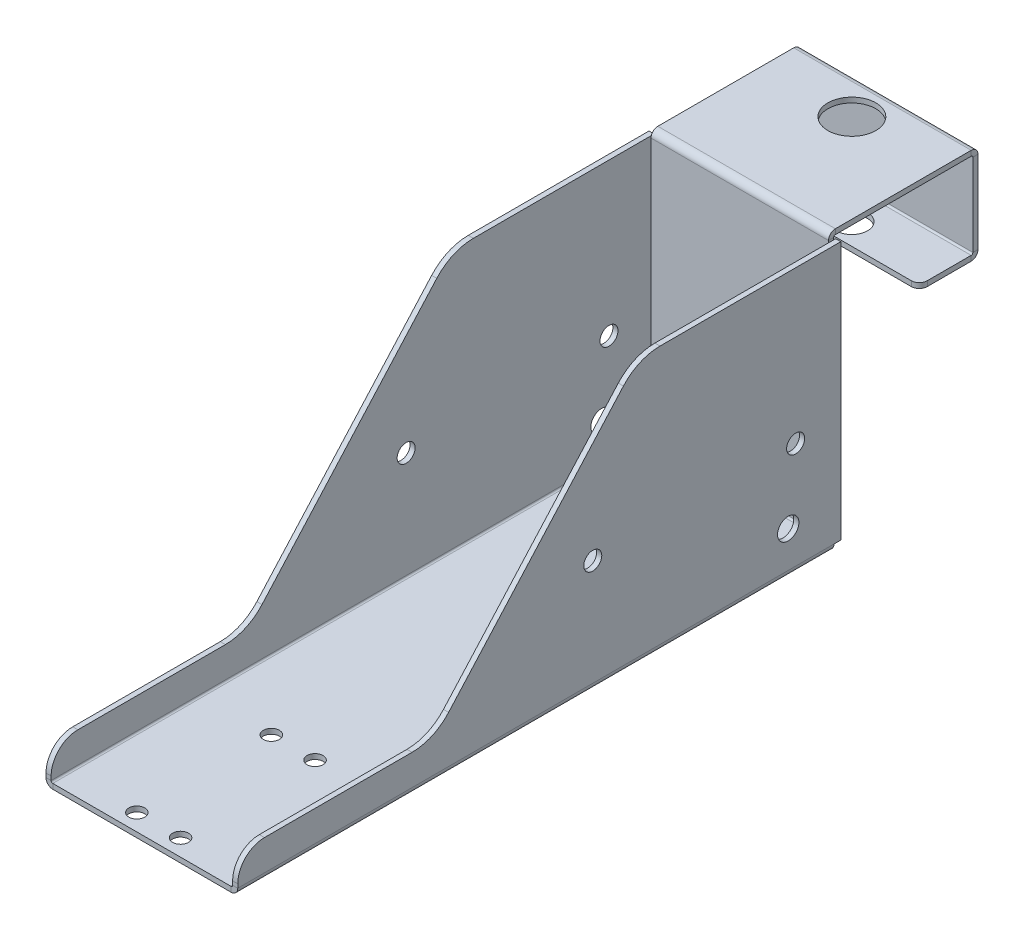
SolidWorks part; units mm, degrees
ref_plane "Front Plane" through (0, 0, 0) normal (0, 0, 1) x (1, 0, 0)
ref_plane "Top Plane" through (0, 0, 0) normal (0, 1, 0) x (1, 0, 0)
ref_plane "Right Plane" through (0, 0, 0) normal (1, 0, 0) x (0, 0, -1)
body saved out of another part "Stock-Piranha-h0400-4301-1"
ref_plane "Plane1" through (341.5928, 0, 0) normal (1, 0, 0) x (0, 0, -1)
flatten bends "Flatten-Bends8" thickness 3.048 parameters "D1"=0
sketch "Sharp-Sketch8" plane through (0, 76.9952, 0) normal (0, 1, 0) x (1, 0, 0)
  line L0 (396.2868, -143.515) -> (396.2868, 211.085) construction
  line L1 (286.8988, 211.085) -> (286.8988, -143.515) construction
  line L2 (394.3772, 212.804) -> (288.8085, 212.804) construction
  line L3 (288.8085, 369.944) -> (394.3772, 369.944) construction
  line L4 (288.8085, 454.1861) -> (394.3772, 454.1861) construction
  line L5 (288.8085, 506.6781) -> (394.3772, 506.6781) construction
bend "SharpBend11" bend angle 90 parameters "D1"=0, "D5"=2
bend "SharpBend12" bend angle 90 parameters "D1"=0, "D5"=1
bend "RoundBend25" bend radius 1 bend angle 90 parameters "D5"=6
bend "RoundBend26" bend radius 1 bend angle 90 parameters "D5"=5
bend "RoundBend27" bend radius 1 bend angle 90 parameters "D5"=4
bend "RoundBend28" bend radius 1 bend angle 90 parameters "D5"=3
process bends "Process-Bends8" thickness 3.048 parameters "D1"=0
sketch "Flat-Sketch8" plane through (0, 76.9952, 0) normal (0, 1, 0) x (1, 0, 0)
sketch "Bend-Lines15" [suppressed] plane through (0, 0, 0) normal (0, 1, 0) x (1, 0, 0)
sketch "Bounding-Box15" [suppressed] plane through (0, 0, 0) normal (0, 1, 0) x (1, 0, 0)
sheet metal parameters "Sheet-Metal10" thickness 3.048 parameters "D1"=1
flat pattern "Flat-Pattern10"
sketch "Bend-Lines16" plane through (0, 76.9952, 0) normal (0, 1, 0) x (1, 0, 0)
  line L0 (288.8085, 468.5781) -> (394.3772, 468.5781) construction
  line L1 (288.8085, 435.1361) -> (394.3772, 435.1361) construction
  line L2 (288.8085, 350.894) -> (394.3772, 350.894) construction
  line L3 (288.8085, 212.804) -> (394.3772, 212.804) construction
  line L4 (286.8988, -143.515) -> (286.8988, 211.085) construction
  line L5 (396.2868, 211.085) -> (396.2868, -143.515) construction
  line L6 (288.8085, 468.5781) -> (394.3772, 468.5781) construction
  line L7 (288.8085, 435.1361) -> (394.3772, 435.1361) construction
  line L8 (288.8085, 350.894) -> (394.3772, 350.894) construction
  line L9 (288.8085, 212.804) -> (394.3772, 212.804) construction
  line L10 (286.8988, -143.515) -> (286.8988, 211.085) construction
  line L11 (396.2868, 211.085) -> (396.2868, -143.515) construction
sketch3d "Bounding-Box16" [suppressed]
  line L0 (137.09, 644.6891, 0) -> (137.09, 0, 0) construction
  line L1 (-245.04, 644.6891, 0) -> (-245.04, 0, 0) construction
  line L2 (137.09, 644.6891, 0) -> (-245.04, 644.6891, 0) construction
  line L3 (137.09, 0, 0) -> (-245.04, 0, 0) construction
bend of the flat pattern "Flatten-<SharpBend11>1"
bend of the flat pattern "Flatten-<SharpBend12>1"
bend of the flat pattern "Flatten-<RoundBend25>1"
bend of the flat pattern "Flatten-<RoundBend26>1"
bend of the flat pattern "Flatten-<RoundBend27>1"
bend of the flat pattern "Flatten-<RoundBend28>1"
